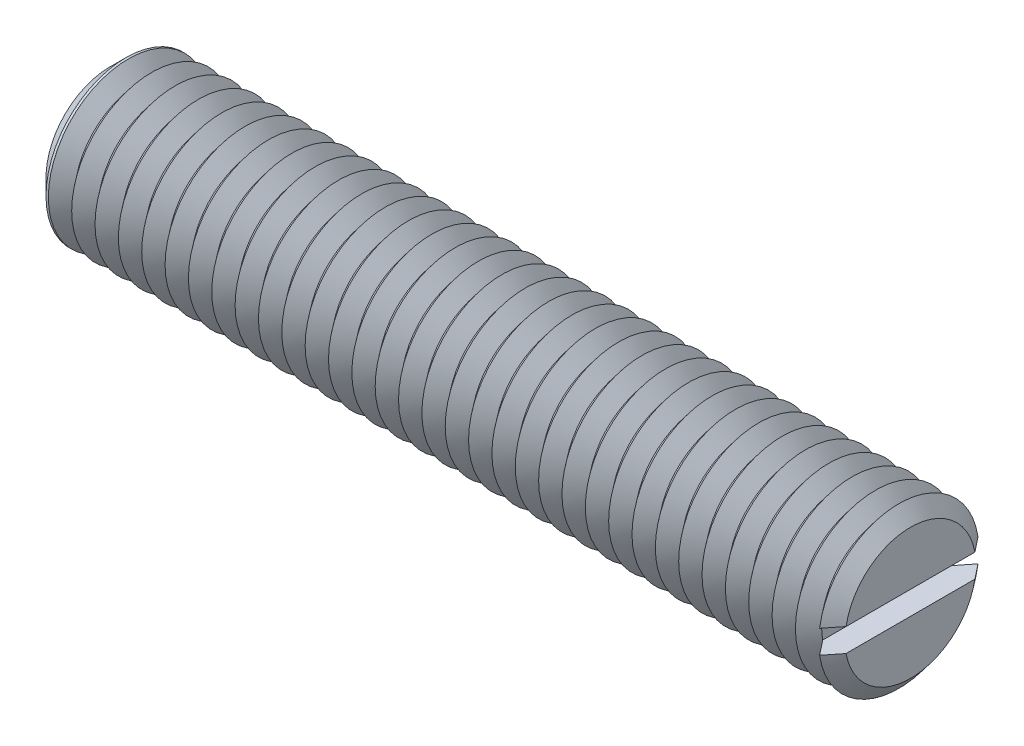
SolidWorks part; units mm, degrees
ref_plane "Front Plane" through (0, 0, 0) normal (0, 0, 1) x (1, 0, 0)
ref_plane "Top Plane" through (0, 0, 0) normal (0, 1, 0) x (1, 0, 0)
ref_plane "Right Plane" through (0, 0, 0) normal (1, 0, 0) x (0, 0, -1)
sketch "Sketch1" plane through (0, 0, 0) normal (1, 0, 0) x (0, 0, -1)
  circle A0 centre (0, 0) radius 6
  dimension "D1" = 12
extrude "Extrude1" add sketch "Sketch1" along normal mid plane 60
sketch "Sketch2" plane through (0, 0, 0) normal (0, 0, 1) x (1, 0, 0)
  line L0 (30, 0.875) -> (28.25, 0.875)
  line L1 (30, -6) -> (30, 6) construction
  line L2 (28.25, 0.875) -> (28.25, -0.875)
  line L3 (0, 0) -> (50000, 0) construction
  line L4 (30, -0.875) -> (28.25, -0.875)
  line L5 (30, -0.875) -> (30, 0.875)
  point P9 (28.25, 0)
  dimension "D1" = 1.75
extrude "Extrude2" cut sketch "Sketch2" against normal mid plane 18
chamfer "Chamfer1" distance 1.2 angle 45 1 edges at (-30, 0, -6)
sketch "Sketch3" plane through (0, 0, 0) normal (0, 0, 1) x (1, 0, 0)
  line L0 (0, 0) -> (30.9602, 0) construction
  line L1 (29.125, -6) -> (30.875, -6)
  line L2 (-28.8, -6) -> (30, -6) construction
  line L3 (30.875, -6) -> (30, -4.9071)
  line L4 (30, -6) -> (30, -0.875) construction
  line L5 (30, -4.9071) -> (29.125, -6)
  dimension "D1" = 1.75
  dimension "D2" = 1.4
revolve "Cut-Revolve1" cut sketch "Sketch3" angle 360 about L0
pattern_linear "LPattern1" count 34 spacing 1.75 along (-1, 0, 0) of "Cut-Revolve1"
equation "\"D2@Sketch3\" = \"D1@Sketch3\"*0.8"
